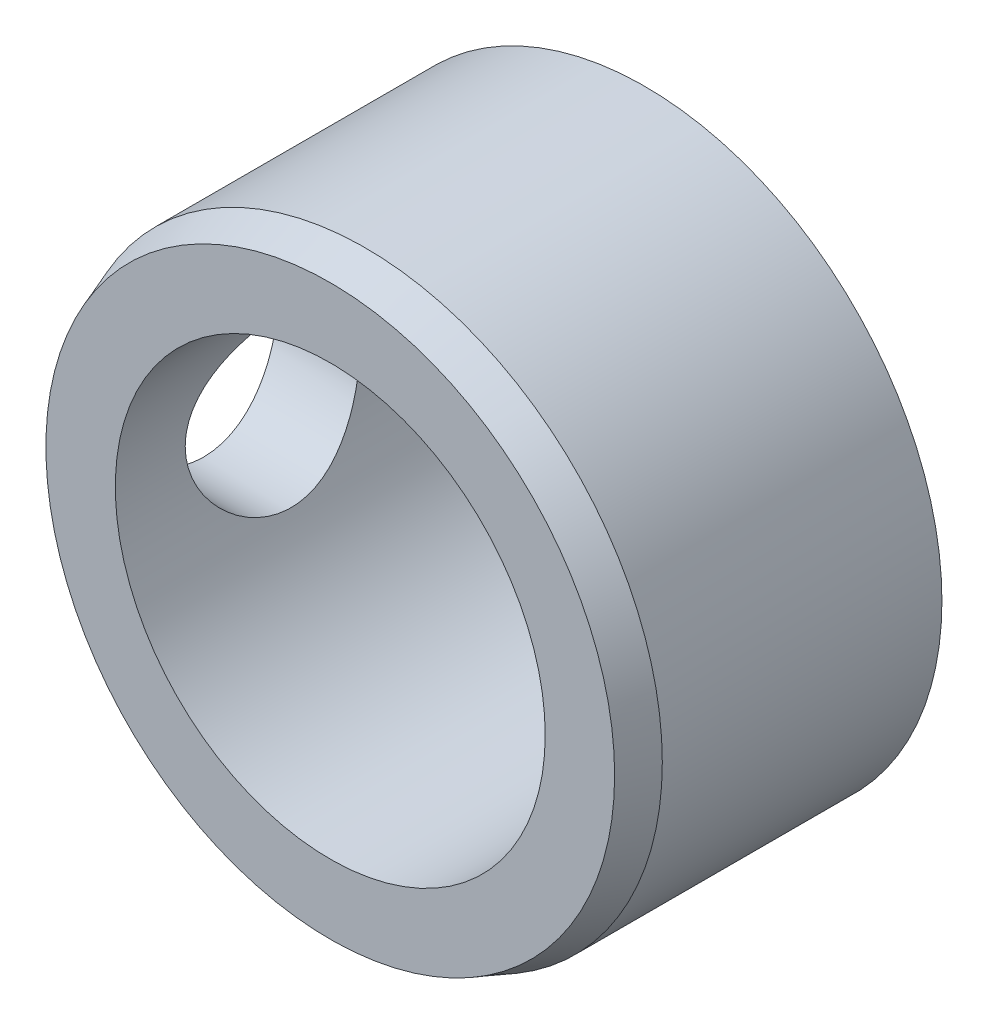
SolidWorks part; units mm, degrees
ref_plane "Plan1" through (0, 0, 0) normal (0, 0, 1) x (1, 0, 0)
ref_plane "Plan2" through (0, 0, 0) normal (0, 1, 0) x (1, 0, 0)
ref_plane "Plan3" through (0, 0, 0) normal (1, 0, 0) x (0, 0, -1)
sketch "Esquisse1" plane through (0, 0, 0) normal (0, 0, 1) x (1, 0, 0)
  line L0 (-100, 0) -> (100, 0) construction
  line L1 (0, 60) -> (0, -60) construction
  circle A0 centre (0, 0) radius 17
  dimension "D1" = 34
extrude "Base-Extrusion" add sketch "Esquisse1" along normal blind 18
sketch "Esquisse2" plane through (0, 0, 18) normal (0, 0, 1) x (1, 0, 0)
  circle A0 centre (0, 0) radius 12.3
  dimension "D1" = 24.6
extrude "Enlèv. mat.-Extru.1" cut sketch "Esquisse2" against normal through all
chamfer "Chanfrein1" distance 2 angle 20
ref_plane "Plan4" through (-17, 0, 0) normal (1, 0, 0) x (0, 0, -1)
sketch "Esquisse3" plane through (-17, 0, 0) normal (1, 0, 0) x (0, 0, -1)
  line L0 (-22.6485, 0) -> (10.5146, 0) construction
  line L1 (-16, 0) -> (0, 0) construction
  line L2 (-9, 20) -> (-9, -20) construction
  line L4 (-18, 16.2721) -> (-18, -16.2721) construction
  circle A0 centre (-9, 0) radius 5
  dimension "D2" = 10
  dimension "D1" = 9
extrude "Enlèv. mat.-Extru.3" cut sketch "Esquisse3" along normal blind 10
